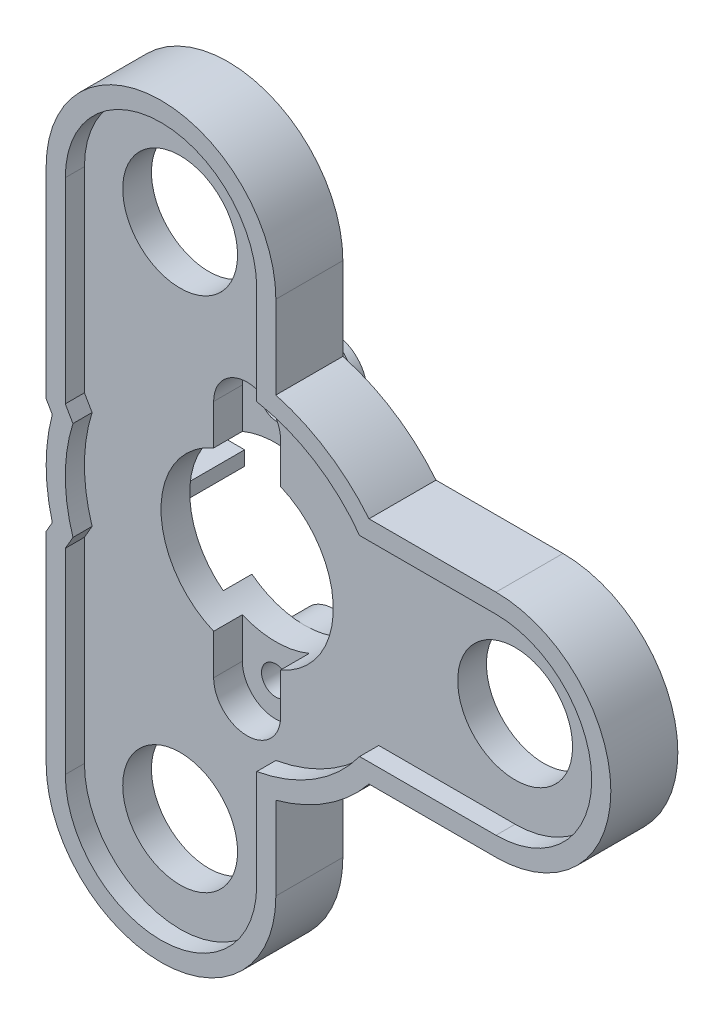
SolidWorks part; units mm, degrees
ref_plane "Face" through (0, 0, 0) normal (0, 0, 1) x (1, 0, 0)
ref_plane "Dessus" through (0, 0, 0) normal (0, 1, 0) x (1, 0, 0)
ref_plane "Droite" through (0, 0, 0) normal (1, 0, 0) x (0, 0, -1)
sketch "Esquisse1" plane through (0, 0, 0) normal (0, 0, 1) x (1, 0, 0)
  line L0 (-7, 27) -> (-7, -27) construction
  line L1 (-48.4638, 0) -> (28, 0) construction
  line L2 (28, 12) -> (14.7309, 12)
  line L3 (28, -12) -> (14.7309, -12)
  line L4 (5, 27) -> (5, 18.3303)
  line L5 (-19, 27) -> (-19, 6)
  line L6 (-19, 6) -> (-18.3597, 4.891)
  line L7 (-19, -6) -> (-18.3597, -4.891)
  line L8 (-19, -27) -> (-19, -6)
  line L9 (5, -27) -> (5, -18.3303)
  arc A0 (5, 27) -> (-19, 27) centre (-7, 27) ccw
  arc A1 (14.7309, -12) -> (5, -18.3303) centre (0, 0) cw
  arc A2 (28, -12) -> (28, 12) centre (28, 0) ccw
  arc A3 (14.7309, 12) -> (5, 18.3303) centre (0, 0) ccw
  arc A4 (-18.3597, 4.891) -> (-18.3597, -4.891) centre (0, 0) ccw
  arc A5 (5, -27) -> (-19, -27) centre (-7, -27) cw
  circle A6 centre (0, 0) radius 9
  circle A7 centre (-7, -27) radius 6
  circle A8 centre (-7, 27) radius 6
  circle A9 centre (28, 0) radius 6
  dimension "D5" = 24
  dimension "D6" = 24
  dimension "D7" = 60
  dimension "D8" = 38
  dimension "D2" = 18
  dimension "D10" = 12
  dimension "D11" = 12
  dimension "D12" = 12
  dimension "D1" = 7
  dimension "D3" = 54
  dimension "D4" = 35
  dimension "D9" = 6
extrude "Extrusion1" add sketch "Esquisse1" along normal mid plane 7
sketch "Esquisse3" plane through (0, 0, 3.5) normal (0, 0, 1) x (1, 0, 0)
  line L16 (-16.2007, -5.1515) -> (-17, -6.5359)
  line L17 (-17, -6.5359) -> (-17, -27)
  line L18 (3, -27) -> (3, -16.7332)
  line L19 (13.7477, -10) -> (28, -10)
  line L20 (28, 10) -> (13.7477, 10)
  line L21 (3, 16.7332) -> (3, 27)
  line L22 (-17, 27) -> (-17, 6.5359)
  line L23 (-17, 6.5359) -> (-16.2007, 5.1515)
  line L24 (-16.2007, -5.1515) -> (-17, -6.5359)
  line L25 (-17, -6.5359) -> (-17, -27)
  line L26 (3, -27) -> (3, -16.7332)
  line L27 (13.7477, -10) -> (28, -10)
  line L28 (28, 10) -> (13.7477, 10)
  line L29 (3, 16.7332) -> (3, 27)
  line L30 (-17, 27) -> (-17, 6.5359)
  line L31 (-17, 6.5359) -> (-16.2007, 5.1515)
  arc A12 (-16.2007, 5.1515) -> (-16.2007, -5.1515) centre (0, 0) ccw
  arc A13 (-17, -27) -> (3, -27) centre (-7, -27) ccw
  arc A14 (3, -16.7332) -> (13.7477, -10) centre (0, 0) ccw
  arc A15 (28, -10) -> (28, 10) centre (28, 0) ccw
  arc A16 (13.7477, 10) -> (3, 16.7332) centre (0, 0) ccw
  arc A17 (3, 27) -> (-17, 27) centre (-7, 27) ccw
  arc A18 (-16.2007, 5.1515) -> (-16.2007, -5.1515) centre (0, 0) ccw
  arc A19 (-17, -27) -> (3, -27) centre (-7, -27) ccw
  arc A20 (3, -16.7332) -> (13.7477, -10) centre (0, 0) ccw
  arc A21 (28, -10) -> (28, 10) centre (28, 0) ccw
  arc A22 (13.7477, 10) -> (3, 16.7332) centre (0, 0) ccw
  arc A23 (3, 27) -> (-17, 27) centre (-7, 27) ccw
  dimension "D1" = 2
extrude "Enlèv. mat.-Extru.1" cut sketch "Esquisse3" against normal blind 2
sketch "Esquisse4" plane through (0, 0, -3.5) normal (0, 0, -1) x (-1, 0, 0)
  line L16 (16.2007, 5.1515) -> (17, 6.5359)
  line L17 (17, 6.5359) -> (17, 27)
  line L18 (-3, 27) -> (-3, 16.7332)
  line L19 (-13.7477, 10) -> (-28, 10)
  line L20 (-28, -10) -> (-13.7477, -10)
  line L21 (-3, -16.7332) -> (-3, -27)
  line L22 (17, -27) -> (17, -6.5359)
  line L23 (17, -6.5359) -> (16.2007, -5.1515)
  line L25 (17, 12) -> (17, 27)
  line L26 (-3, 27) -> (-3, 19.8997)
  line L27 (-17.8606, 10) -> (-28, 10)
  line L28 (-28, -10) -> (-17.8606, -10)
  line L29 (-3, -19.8997) -> (-3, -27)
  line L30 (17, -27) -> (17, -12)
  arc A6 (-1.9, -18.9048) -> (15.2, -11.4) centre (0, 0) ccw
  circle A7 centre (0, 0) radius 17
  arc A8 (15.2, 11.4) -> (-1.9, 18.9048) centre (0, 0) ccw
  arc A9 (-16.9675, 8.55) -> (-16.9675, -8.55) centre (0, 0) ccw
  arc A10 (-16.9675, -8.55) -> (-17.8606, -10) centre (-17.8606, -9) cw
  arc A11 (-17.8606, 10) -> (-16.9675, 8.55) centre (-17.8606, 9) cw
  arc A12 (16.2007, -5.1515) -> (16.2007, 5.1515) centre (0, 0) ccw
  arc A13 (17, 27) -> (-3, 27) centre (7, 27) ccw
  arc A14 (-3, 16.7332) -> (-13.7477, 10) centre (0, 0) ccw
  arc A15 (-28, 10) -> (-28, -10) centre (-28, 0) ccw
  arc A16 (-13.7477, -10) -> (-3, -16.7332) centre (0, 0) ccw
  arc A17 (-3, -27) -> (17, -27) centre (7, -27) ccw
  arc A18 (-1.9, 18.9048) -> (-3, 19.8997) centre (-2, 19.8997) cw
  arc A19 (17, 27) -> (-3, 27) centre (7, 27) ccw
  arc A20 (17, 12) -> (15.2, 11.4) centre (16, 12) cw
  arc A21 (-28, 10) -> (-28, -10) centre (-28, 0) ccw
  arc A22 (17, -12) -> (15.2, -11.4) centre (16, -12) ccw
  arc A23 (-3, -27) -> (17, -27) centre (7, -27) ccw
  arc A24 (-3, -19.8997) -> (-1.9, -18.9048) centre (-2, -19.8997) cw
  dimension "D2" = 1
  dimension "D1" = 2
extrude "Enlèv. mat.-Extru.2" cut sketch "Esquisse4" against normal blind 2
sketch "Esquisse6" plane through (0, 0, -1.5) normal (0, 0, -1) x (-1, 0, 0)
  line L0 (0, 0) -> (25.257, 0) construction
  line L2 (9.2623, 0.75) -> (17.1394, 0.75)
  line L3 (9.2623, 0.75) -> (9.2623, -0.75)
  line L4 (9.2623, -0.75) -> (17.1394, -0.75)
  line L5 (17.1394, 0.75) -> (17.1394, -0.75)
  dimension "D1" = 1.5
  dimension "D2" = 0.75
extrude "Extrusion4" add sketch "Esquisse6" along normal blind 6
pattern_circular "Répétition circulaire1" count 2 over 360
sketch "Esquisse7" plane through (0, 0, -1.5) normal (0, 0, -1) x (-1, 0, 0)
  line L0 (0, 0) -> (0, 21.5613) construction
  line L1 (5.5, 14) -> (5.5, 7.1239)
  line L2 (-5.5, 14) -> (-5.5, 7.1239)
  line L3 (0, 0) -> (25.5528, 0) construction
  line L4 (-5.5, -14) -> (-5.5, -7.1239)
  line L5 (5.5, -14) -> (5.5, -7.1239)
  arc A0 (5.5, 14) -> (-5.5, 14) centre (0, 14) ccw
  circle A1 centre (0, 0) radius 9 construction
  arc A2 (5.5, 7.1239) -> (-5.5, 7.1239) centre (0, 0) ccw
  arc A3 (5.5, -7.1239) -> (-5.5, -7.1239) centre (0, 0) cw
  arc A4 (5.5, -14) -> (-5.5, -14) centre (0, -14) cw
  dimension "D1" = 11
  dimension "D2" = 14
extrude "Extrusion5" add sketch "Esquisse7" along normal blind 3
sketch "Esquisse8" plane through (0, 0, 1.5) normal (0, 0, 1) x (1, 0, 0)
  line L0 (0, 0) -> (0, 17.9202) construction
  line L1 (3.5, 12.5) -> (3.5, -12.5)
  line L2 (-3.5, 12.5) -> (-3.5, -12.5)
  line L3 (0, 0) -> (43.6595, 0) construction
  arc A0 (3.5, 12.5) -> (-3.5, 12.5) centre (0, 12.5) ccw
  arc A1 (3.5, -12.5) -> (-3.5, -12.5) centre (0, -12.5) cw
  point P10 (3.5, 0)
  point P12 (-3.5, 0)
  dimension "D1" = 7
  dimension "D2" = 12.5
extrude "Enlèv. mat.-Extru.3" cut sketch "Esquisse8" against normal blind 3
sketch "Esquisse10" plane through (0, 0, -4.5) normal (0, 0, -1) x (-1, 0, 0)
  circle A0 centre (0, 12.5) radius 3.5
  circle A1 centre (0, -12.5) radius 3.5
extrude "Extrusion6" add sketch "Esquisse10" along normal blind 3
sketch "Esquisse11" plane through (0, 0, -7.5) normal (0, 0, -1) x (-1, 0, 0)
  circle A0 centre (0, -12.5) radius 1.5
  circle A1 centre (0, 12.5) radius 1.5
  dimension "D1" = 3
  dimension "D2" = 3
extrude "Enlèv. mat.-Extru.4" cut sketch "Esquisse11" against normal through all
